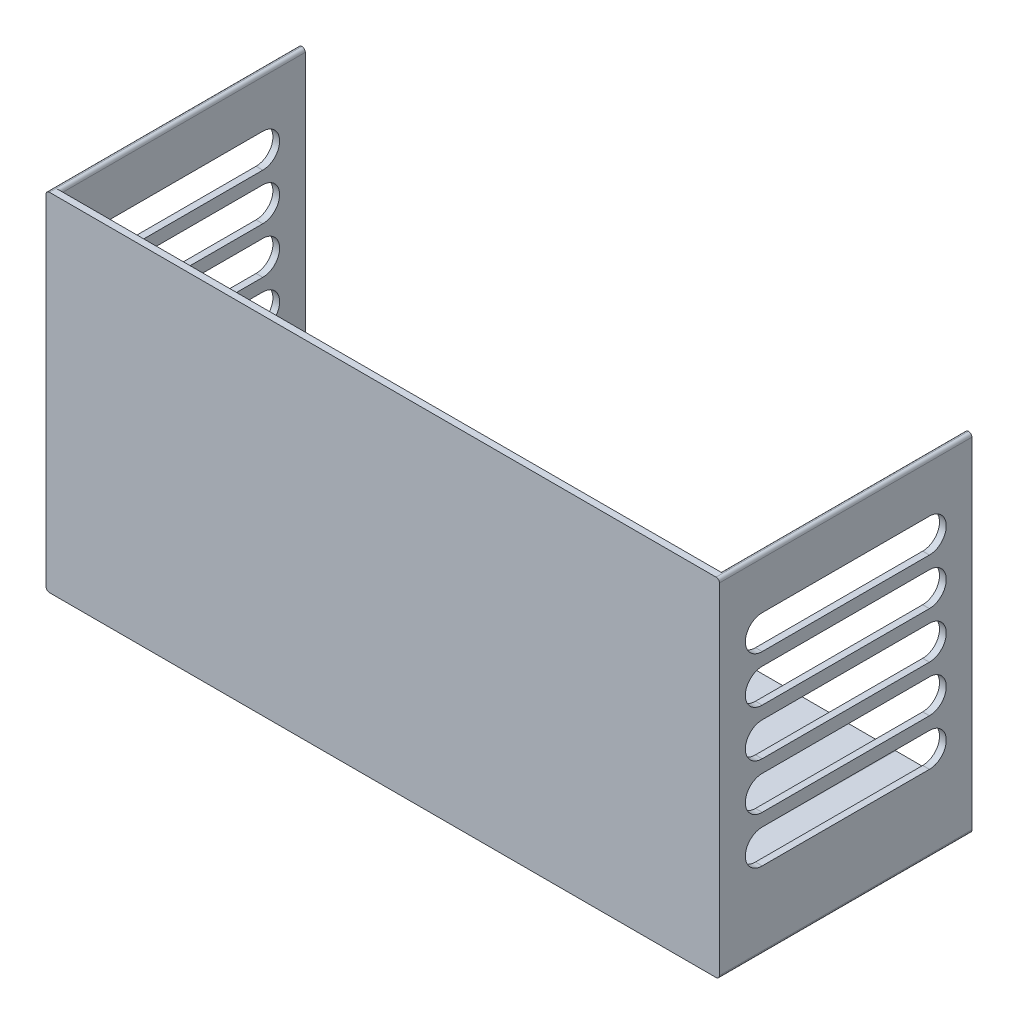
SolidWorks part; units mm, degrees
ref_plane "Front Plane" through (0, 0, 0) normal (0, 0, 1) x (1, 0, 0)
ref_plane "Top Plane" through (0, 0, 0) normal (0, 1, 0) x (1, 0, 0)
ref_plane "Right Plane" through (0, 0, 0) normal (1, 0, 0) x (0, 0, -1)
sketch "Sketch1" plane through (0, 0, 0) normal (0, 1, 0) x (1, 0, 0)
  line L1 (-100, -37.5) -> (100, -37.5)
  line L2 (-100, -37.5) -> (-100, 37.5)
  line L3 (-100, 37.5) -> (100, 37.5)
  line L4 (100, -37.5) -> (100, 37.5)
  line L5 (-100, -37.5) -> (100, 37.5) construction
  line L6 (-100, 37.5) -> (100, -37.5) construction
  point P0 (0, 0)
  dimension "D1" = 200
  dimension "D2" = 75
extrude "Boss-Extrude1" add sketch "Sketch1" along normal mid plane 103
shell "Shell2" thickness 2
sketch "Sketch2" plane through (0, 0, 35.5) normal (0, 0, -1) x (-1, 0, 0)
  line L6 (-100, -51.5) -> (100, -51.5) construction
  line L7 (-98, 51.5) -> (-98, -41.5) construction
  line L71 (-82, -49) -> (-69.3, -49)
  line L72 (-83, -48) -> (-83, -43.75)
  line L73 (-82, -42.75) -> (-69.3, -42.75)
  line L74 (-68.3, -48) -> (-68.3, -43.75)
  line L75 (-83, -49) -> (-68.3, -42.75) construction
  line L76 (-83, -42.75) -> (-68.3, -49) construction
  arc A32 (-69.3, -49) -> (-68.3, -48) centre (-69.3, -48) ccw
  arc A33 (-69.3, -42.75) -> (-68.3, -43.75) centre (-69.3, -43.75) cw
  arc A34 (-82, -49) -> (-83, -48) centre (-82, -48) cw
  arc A35 (-83, -43.75) -> (-82, -42.75) centre (-82, -43.75) cw
  point P0 (-75.65, -45.875)
  point P17 (-75.65, -45.875)
  point P35 (-68.3, -45.875)
  dimension "D7" = 14.7
  dimension "D8" = 6.25
  dimension "D5" = 1
  dimension "D1" = 8.75
  dimension "D6" = 15
sketch "Sketch24" plane through (0, 0, 35.5) normal (0, 0, -1) x (-1, 0, 0)
  point P0 (-30.65, -45.875)
  point P1 (44.35, -45.875)
  point P2 (69.35, -45.875)
  dimension "D1" = 45
  dimension "D2" = 75
  dimension "D3" = 25
sketch "Sketch26" plane through (0, 0, 35.5) normal (0, 0, -1) x (-1, 0, 0)
  line L1 (-81.5, -47.9117) -> (-67.5, -47.9117)
  line L2 (-82.5, -46.9117) -> (-82.5, -44.4116)
  line L4 (-66.5, -46.9117) -> (-66.5, -44.4116)
  line L5 (-82.5, -47.9117) -> (-71.6156, -44.6755) construction
  line L6 (-77.5868, -45.4439) -> (-66.5, -47.9117) construction
  line L7 (-82, -49) -> (-69.3, -49) construction
  line L8 (-83, -48) -> (-83, -43.75) construction
  line L9 (-68.3, -48) -> (-68.3, -43.75) construction
  line L10 (-81.5157, -43.4117) -> (-77, -43.4117)
  line L11 (-76, -42.4117) -> (-76, -40.9117)
  line L12 (-76, -40.9117) -> (-73, -40.9117)
  line L13 (-73, -40.9117) -> (-73, -42.4117)
  line L14 (-72, -43.4117) -> (-67.4843, -43.4117)
  arc A0 (-81.5, -47.9117) -> (-82.5, -46.9117) centre (-81.5, -46.9117) cw
  arc A1 (-67.5, -47.9117) -> (-66.5, -46.9117) centre (-67.5, -46.9117) ccw
  arc A2 (-67.4843, -43.4117) -> (-66.5, -44.4116) centre (-67.5, -44.4116) cw
  arc A3 (-82.5, -44.4116) -> (-81.5157, -43.4117) centre (-81.5, -44.4116) cw
  arc A4 (-73, -42.4117) -> (-72, -43.4117) centre (-72, -42.4117) ccw
  arc A5 (-77, -43.4117) -> (-76, -42.4117) centre (-77, -42.4117) ccw
  point P1 (-75.65, -45.875)
  point P30 (-73, -43.4117)
  dimension "D3" = 1
  dimension "D7" = 1
  dimension "D1" = 16
  dimension "D2" = 3
  dimension "D4" = 6.5
  dimension "D5" = 4.5
  dimension "D6" = 2.5
extrude "Cut-Extrude4" cut sketch "Sketch26" along normal through all draft 0.25
pattern_sketch "Sketch-Pattern2" of "Cut-Extrude4"
sketch "Sketch17" plane through (-100, 0, 0) normal (-1, 0, 0) x (0, 0, 1)
  line L0 (-24.8712, 31.5) -> (24.8, 31.5) construction
  line L1 (-24.8712, 36.5) -> (24.8, 36.5)
  line L2 (-24.8712, 26.5) -> (24.8, 26.5)
  line L3 (-37.5, 51.5) -> (37.5, 51.5) construction
  line L4 (-24.8712, 12.7167) -> (24.8, 12.7167)
  line L5 (37.5, 51.5) -> (37.5, -51.5) construction
  line L6 (-37.5, 51.5) -> (-37.5, -51.5) construction
  line L7 (-24.8712, 22.7167) -> (24.8, 22.7167)
  line L8 (-24.8712, 17.7167) -> (24.8, 17.7167) construction
  line L9 (-24.8712, -1.0667) -> (24.8, -1.0667)
  line L10 (-24.8712, 8.9333) -> (24.8, 8.9333)
  line L11 (-24.8712, 3.9333) -> (24.8, 3.9333) construction
  line L12 (-24.8712, -14.85) -> (24.8, -14.85)
  line L13 (-24.8712, -4.85) -> (24.8, -4.85)
  line L14 (-24.8712, -9.85) -> (24.8, -9.85) construction
  line L15 (-24.8712, -28.6333) -> (24.8, -28.6333)
  line L16 (-24.8712, -18.6333) -> (24.8, -18.6333)
  line L17 (-24.8712, -23.6333) -> (24.8, -23.6333) construction
  line L24 (-24.8712, -46.2) -> (24.8, -46.2)
  line L25 (-24.8712, -56.2) -> (24.8, -56.2)
  line L26 (-24.8712, -32.4167) -> (24.8, -32.4167)
  line L27 (-24.8712, -42.4167) -> (24.8, -42.4167)
  arc A0 (-24.8712, 36.5) -> (-24.8712, 26.5) centre (-24.8712, 31.5) ccw
  arc A1 (24.8, 26.5) -> (24.8, 36.5) centre (24.8, 31.5) ccw
  arc A2 (-24.8712, 22.7167) -> (-24.8712, 12.7167) centre (-24.8712, 17.7167) ccw
  arc A3 (24.8, 12.7167) -> (24.8, 22.7167) centre (24.8, 17.7167) ccw
  arc A4 (-24.8712, 8.9333) -> (-24.8712, -1.0667) centre (-24.8712, 3.9333) ccw
  arc A5 (24.8, -1.0667) -> (24.8, 8.9333) centre (24.8, 3.9333) ccw
  arc A6 (-24.8712, -4.85) -> (-24.8712, -14.85) centre (-24.8712, -9.85) ccw
  arc A7 (24.8, -14.85) -> (24.8, -4.85) centre (24.8, -9.85) ccw
  arc A8 (-24.8712, -18.6333) -> (-24.8712, -28.6333) centre (-24.8712, -23.6333) ccw
  arc A9 (24.8, -28.6333) -> (24.8, -18.6333) centre (24.8, -23.6333) ccw
  arc A14 (-24.8712, -46.2) -> (-24.8712, -56.2) centre (-24.8712, -51.2) ccw
  arc A15 (24.8, -56.2) -> (24.8, -46.2) centre (24.8, -51.2) ccw
  arc A16 (-24.8712, -32.4167) -> (-24.8712, -42.4167) centre (-24.8712, -37.4167) ccw
  arc A17 (24.8, -42.4167) -> (24.8, -32.4167) centre (24.8, -37.4167) ccw
  point P2 (-0.0356, 31.5)
  point P17 (-0.0356, 17.7167)
  point P24 (-0.0356, 3.9333)
  point P31 (-0.0356, -9.85)
  point P38 (-0.0356, -23.6333)
  dimension "D1" = 20
  dimension "D2" = 12.7
  dimension "D3" = 12.6288
  dimension "D4" = 10
  dimension "D5" = 7
extrude "Cut-Extrude5" cut sketch "Sketch17" against normal through all both and the other way through all
sketch "Sketch27" plane through (0, -51.5, 0) normal (0, -1, 0) x (1, 0, 0)
  line L0 (-100, -37.5) -> (-100, 37.5) construction
  line L1 (-100, 37.5) -> (100, 37.5) construction
  line L2 (0, -41.25) -> (0, 41.25) construction
  line L3 (56.65, 0) -> (-56.65, 0) construction
  point P0 (-92, 29.5)
  point P8 (0, 0)
  point P9 (0, 0)
  point P10 (0, 0)
  point P11 (0, 0)
  point P14 (92, 29.5)
  point P15 (0, 0)
  point P16 (0, 0)
  point P19 (-92, -29.5)
  point P20 (92, -29.5)
  point P21 (0, 0)
  point P22 (0, 0)
  point P23 (0, 0)
  point P24 (0, 0)
  point P25 (0, 0)
  dimension "D1" = 8
  dimension "D2" = 8
fillet "Fillet2" radius 1 22 edges at (28.9907, -41.5, -1) (32.3093, -41.5, -1) (-100, 51.5, 0) (-46.0093, -41.5, -1) (-42.6907, -41.5, -1) (-99, 51.5, -37.5) (-71.0093, -41.5, -1) (-67.6907, -41.5, -1) (98, -41.5, -1) (-98, -41.5, -1) (98, 51.5, -1) (-98, 51.5, -1) (76.1593, -41.5, -1) (72.8407, -41.5, -1) (73, -41.9559, 35.5) (76, -41.9559, 35.5) (72.6815, -41.9559, -37.5) (76.3185, -41.9559, -37.5) (100, 51.5, 0) (-100, -51.5, 0) (100, -51.5, 0) (99, 51.5, -37.5)
hole_wizard "CBORE for M4 SHCS2" positions "Sketch31" profile "Sketch32" counterbore size "M4" standard "ANSI Metric"
sketch "Sketch31" plane through (0, -51.5, 0) normal (0, -1, 0) x (-1, 0, 0)
  point P0 (-92, 29.5)
  point P3 (92, 29.5)
  point P6 (92, -29.5)
  point P9 (-92, -29.5)
sketch "Sketch32" plane through (92, -51.5, -29.5) normal (1, 0, 0) x (0, 0, -1)
  line L0 (0, 0) -> (0, 8.8519)
  line L1 (0, 8.8519) -> (2.25, 7.5)
  line L2 (2.25, 7.5) -> (2.25, 4.7)
  line L3 (2.25, 4.7) -> (3.1496, 4.7)
  line L5 (3.1496, 4.7) -> (3.1496, 0.025)
  line L6 (3.1496, 0.025) -> (3.1746, 0)
  line L7 (3.1746, 0) -> (0, 0)
  line L8 (-3.1496, 0.025) -> (-3.1746, 0) construction
  line L10 (0, 8.8519) -> (-2.25, 7.5) construction
  line L11 (0, -6.35) -> (0, 107.95) construction
  dimension "Hole Dia." = 4.5
  dimension "Hole Depth" = 7.5
  dimension "C'Bore Dia." = 6.2992
  dimension "C'Bore Depth" = 4.7
  dimension "Near C'Sink Dia." = 6.3492
  dimension "Near C'Sink Angle" = 90
  dimension "Drill Angle" = 118
